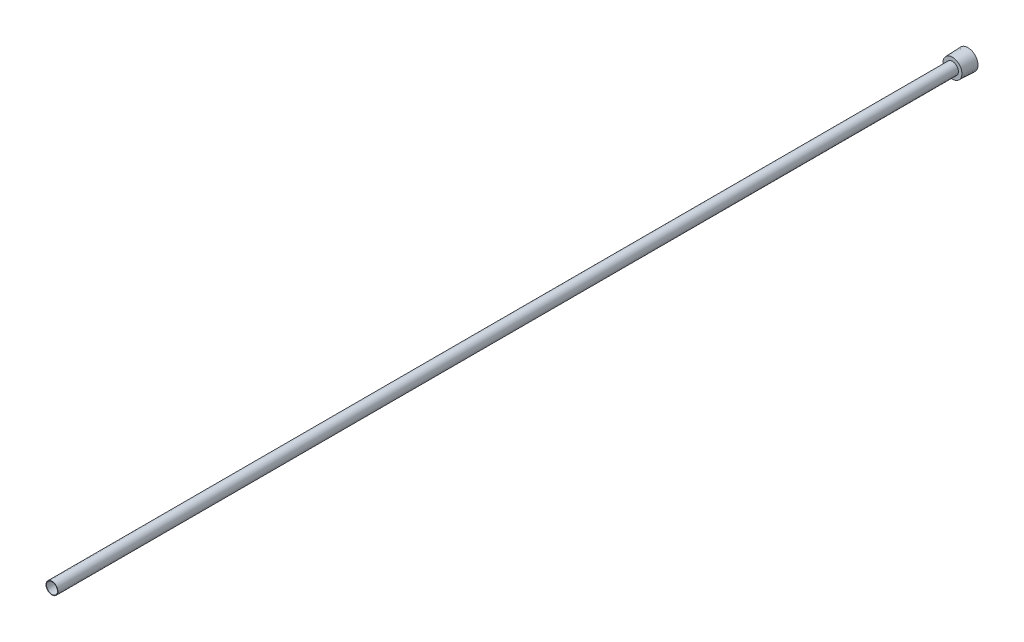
SolidWorks part; units mm, degrees
ref_plane "Front Plane" through (0, 0, 0) normal (0, 0, 1) x (1, 0, 0)
ref_plane "Top Plane" through (0, 0, 0) normal (0, 1, 0) x (1, 0, 0)
ref_plane "Right Plane" through (0, 0, 0) normal (1, 0, 0) x (0, 0, -1)
sketch "Sketch1" plane through (0, 0, 0) normal (1, 0, 0) x (0, 0, -1)
  line L0 (-331.1242, 0) -> (49668.8758, 0) construction
  line L1 (0, 0) -> (-609.6, 0)
  line L6 (0, 0) -> (0, 6.7183)
  line L7 (0, 6.7183) -> (-10.3124, 6.3421)
  line L8 (-10.3124, 3.9688) -> (-609.6, 3.9687)
  line L9 (-10.3124, 6.3421) -> (-10.3124, 3.9688)
  line L10 (-609.6, 3.9687) -> (-609.6, 0)
  dimension "D1" = 7.9375
  dimension "D2" = 10.3124
  dimension "D3" = 2.089
  dimension "D4" = 13.4366
  dimension "D5" = 609.6
revolve "Revolve1" add sketch "Sketch1" angle 360 about L0
sketch "Sketch2" plane through (0, 0, 609.6) normal (0, 0, 1) x (1, 0, 0)
  circle A0 centre (0, 0) radius 3.6512
  dimension "D1" = 7.3025
extrude "Cut-Extrude1" cut sketch "Sketch2" against normal through all
sketch "Sketch3" plane through (0, 0, 0) normal (0, 0, -1) x (-1, 0, 0)
  line L0 (0, 7.3901) -> (0, -7.3901) construction
  line L1 (-4.7625, -2.7496) -> (0, -5.4993)
  line L2 (0, -5.4993) -> (4.7625, -2.7496)
  line L3 (4.7625, -2.7496) -> (4.7625, 2.7496)
  line L4 (4.7625, 2.7496) -> (0, 5.4993)
  line L5 (0, 5.4993) -> (-4.7625, 2.7496)
  line L6 (-4.7625, 2.7496) -> (-4.7625, -2.7496)
  circle A0 centre (0, 0) radius 4.7625 construction
  dimension "D1" = 9.525
extrude "Cut-Extrude2" cut sketch "Sketch3" against normal blind 6.35
